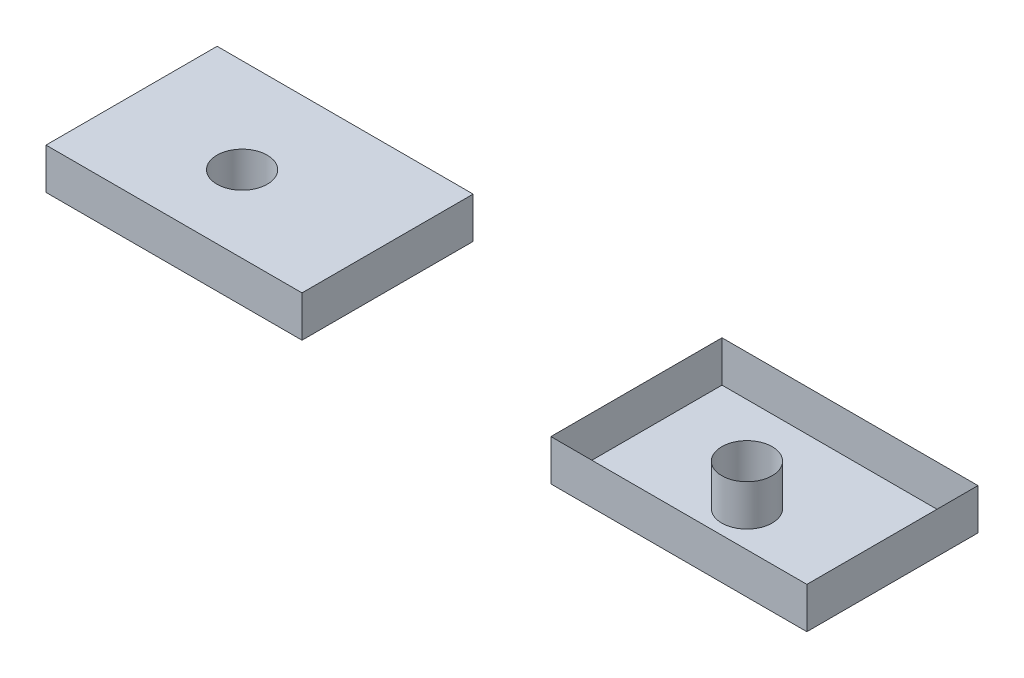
SolidWorks part; units mm, degrees
ref_plane "Front Plane" through (0, 0, 0) normal (0, 0, 1) x (1, 0, 0)
ref_plane "Top Plane" through (0, 0, 0) normal (0, 1, 0) x (1, 0, 0)
ref_plane "Right Plane" through (0, 0, 0) normal (1, 0, 0) x (0, 0, -1)
sketch "Sketch1" plane through (0, 0, 0) normal (0, 1, 0) x (1, 0, 0)
  line L1 (0, 0) -> (50.6728, 0)
  line L2 (0, 0) -> (0, 50.8373)
  line L3 (0, 50.8373) -> (50.6728, 50.8373)
  line L4 (50.6728, 0) -> (50.6728, 50.8373)
sketch "Sketch2" plane through (0, 0, 0) normal (0, 1, 0) x (1, 0, 0)
  line L1 (174.2754, 0) -> (303.8652, 0)
  line L2 (174.2754, 0) -> (174.2754, 86.6255)
  line L3 (174.2754, 86.6255) -> (303.8652, 86.6255)
  line L4 (303.8652, 0) -> (303.8652, 86.6255)
extrude "Extrude1" add sketch "Sketch2" along normal blind 20.7672
sketch "Sketch3" plane through (0, 20.7672, 0) normal (0, 1, 0) x (-1, 0, 0)
  circle A0 centre (-234.6991, -38.8355) radius 12.7581
extrude "Cut-Extrude1" cut sketch "Sketch3" against normal through all
imported_body "Surface-Imported1"
move or copy body "Body-Move/Copy1" bodies to move or copy 104 copy no translate (255.5662, 0, 0)
